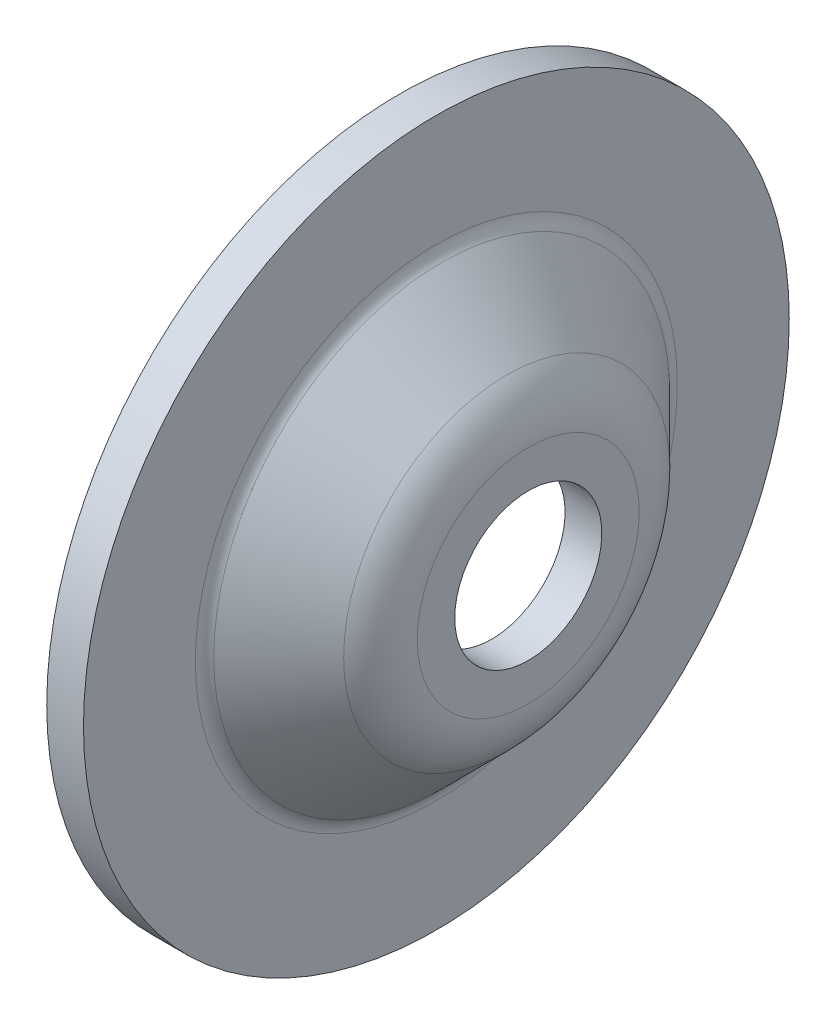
SolidWorks part; units mm, degrees
ref_plane "Plan1" through (0, 0, 0) normal (0, 0, 1) x (1, 0, 0)
ref_plane "Plan2" through (0, 0, 0) normal (0, 1, 0) x (1, 0, 0)
ref_plane "Plan3" through (0, 0, 0) normal (1, 0, 0) x (0, 0, -1)
sketch "Esquisse1" plane through (0, 0, 0) normal (0, 0, 1) x (1, 0, 0)
  line L0 (-28, 0) -> (39, 0) construction
  line L1 (12, 4) -> (12, 7.7)
  line L2 (12, 7.7) -> (7, 12.7)
  line L3 (7, 12.7) -> (7, 19.2)
  line L4 (7, 19.2) -> (5, 19.2)
  line L5 (5, 19.2) -> (5, 11.8716)
  line L6 (5, 11.8716) -> (10, 6.8716)
  line L7 (10, 6.8716) -> (10, 4)
  line L8 (10, 4) -> (12, 4)
  dimension "D1" = 4
  dimension "D2" = 2
  dimension "D3" = 5
  dimension "D4" = 19.2
  dimension "D5" = 7
  dimension "D6" = 6.5
  dimension "D7" = 2
revolve "Base-Révolution" add sketch "Esquisse1" angle 360 about L0
fillet "Congé1" radius 1
fillet "Congé2" radius 4
fillet "Congé4" radius 4
fillet "Congé5" radius 1
